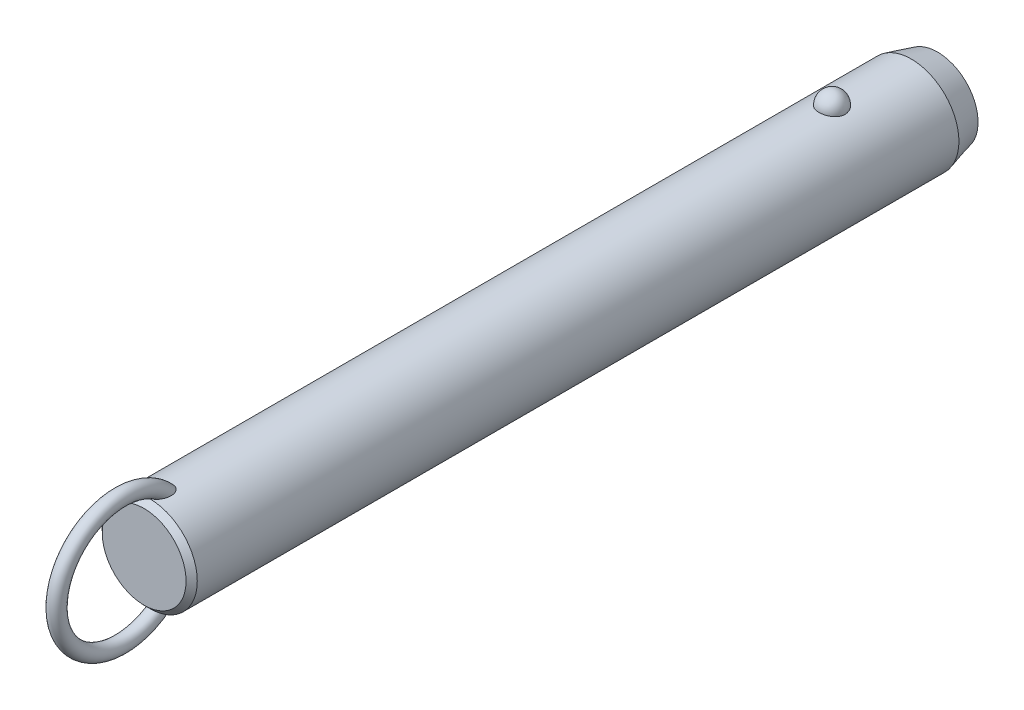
SolidWorks part; units mm, degrees
ref_plane "Front Plane" through (0, 0, 0) normal (0, 0, 1) x (1, 0, 0)
ref_plane "Top Plane" through (0, 0, 0) normal (0, 1, 0) x (1, 0, 0)
ref_plane "Right Plane" through (0, 0, 0) normal (1, 0, 0) x (0, 0, -1)
sketch "Sketch2" plane through (0, 0, 0) normal (0, 0, 1) x (1, 0, 0)
  circle A0 centre (0, 0) radius 12.7
  point P3 (0, 12.7)
  dimension "D1" = 25.4
extrude "Boss-Extrude1" add sketch "Sketch2" along normal blind 167.6
sketch "Sketch3" plane through (0, 0, 0) normal (0, 0, -1) x (-1, 0, 0)
  circle A0 centre (0, 0) radius 12.7
  dimension "D1" = 25.4
extrude "Boss-Extrude2" add sketch "Sketch3" along normal blind 31.7
chamfer "Chamfer1" distance 7 angle 15 1 edges at (-12.7, 0, -31.7)
sketch "Sketch12" plane through (0, 0, 0) normal (1, 0, 0) x (0, 0, -1)
  line L0 (-167.6, 12.7) -> (-167.6, -12.7) construction
  point P0 (-167.6, 0)
sketch "Sketch13" plane through (0, 0, 0) normal (1, 0, 0) x (0, 0, -1)
  circle A0 centre (-186.65, 0) radius 19.05
  point P2 (-167.6, 0)
  dimension "D1" = 38.1
sketch "Sketch14" plane through (0, 0, 0) normal (0, 1, 0) x (1, 0, 0)
  circle A0 centre (0, -169.6) radius 2
  point P2 (0, -167.6)
  dimension "D1" = 4
sweep "Sweep1" add profiles "Sketch14" path "Sketch13"
sketch "Sketch15" plane through (0, 0, 167.6) normal (0, 0, 1) x (1, 0, 0)
  circle A0 centre (0, 0) radius 12.7
  dimension "D1" = 25.4
extrude "Boss-Extrude3" add sketch "Sketch15" along normal blind 12.7
chamfer "Chamfer2" distance 1.5 angle 45 1 edges at (12.7, 0, 180.3)
sketch "Sketch18" plane through (0, 0, 0) normal (1, 0, 0) x (0, 0, -1)
  line L0 (24.7, 12.7) -> (-172.451, 12.7) construction
  line L1 (3.5, 16.2) -> (3.5, 9.2)
  line L2 (-172.451, -12.7) -> (24.7, -12.7) construction
  arc A0 (3.5, 16.2) -> (3.5, 9.2) centre (3.5, 12.7) ccw
  point P4 (0, 12.7)
  dimension "D1" = 28.9
revolve "Revolve1" add sketch "Sketch18" angle 360 about L1
